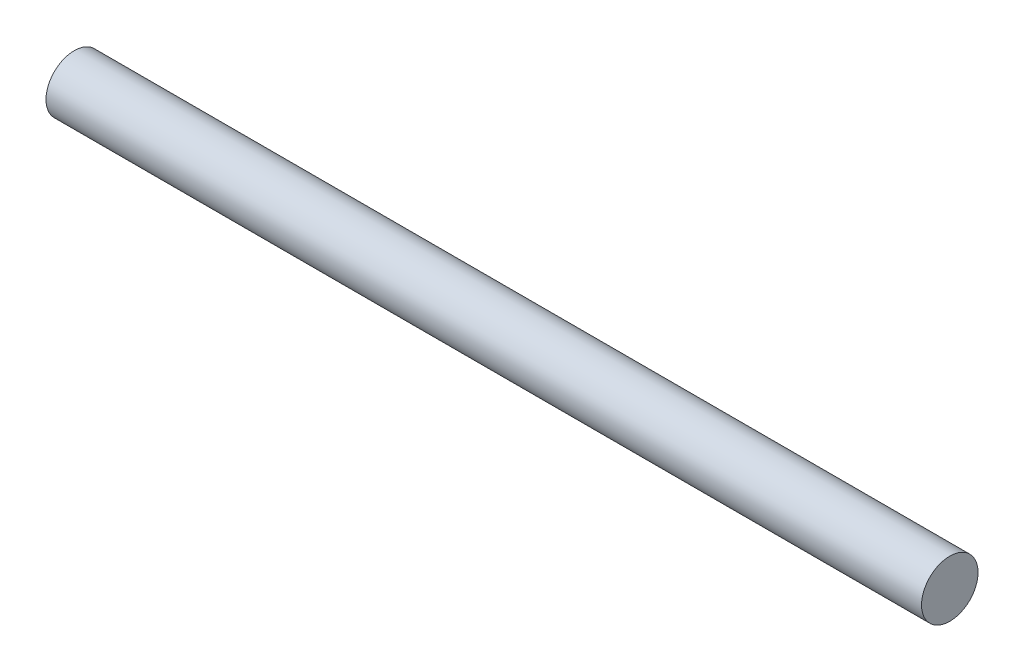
SolidWorks part; units mm, degrees
ref_plane "Ebene vorne" through (0, 0, 0) normal (0, 0, 1) x (1, 0, 0)
ref_plane "Ebene oben" through (0, 0, 0) normal (0, 1, 0) x (1, 0, 0)
ref_plane "Ebene rechts" through (0, 0, 0) normal (1, 0, 0) x (0, 0, -1)
sketch "Skizze1" plane through (0, 0, 0) normal (0, 0, 1) x (1, 0, 0)
  line L0 (-21.9381, 0) -> (21.9381, 0) construction
  line L1 (17.6357, 0) -> (-14.8929, 0)
  line L3 (-14.8929, 0) -> (-14.8929, -1.05)
  line L4 (-14.8929, -1.05) -> (17.6357, -1.05)
  line L5 (17.6357, 0) -> (17.6357, -1.05)
  dimension "D1" = 1.05
revolve "Rotation1" add sketch "Skizze1" angle 360 about L0
